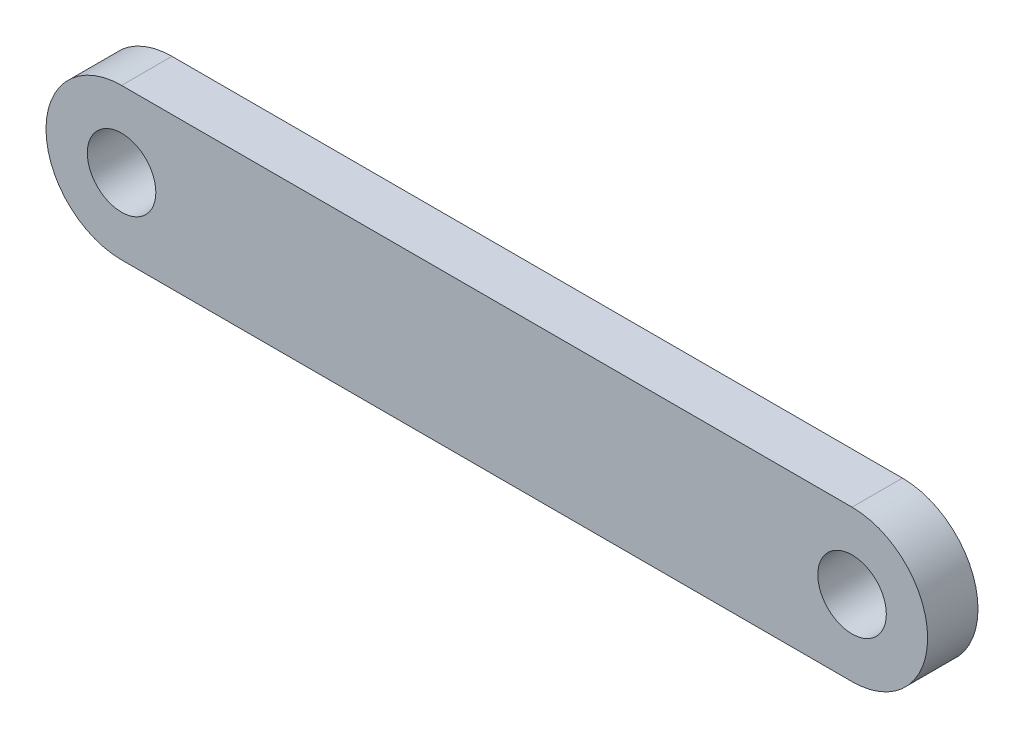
SolidWorks part; units mm, degrees
ref_plane "Front Plane" through (0, 0, 0) normal (0, 0, 1) x (1, 0, 0)
ref_plane "Top Plane" through (0, 0, 0) normal (0, 1, 0) x (1, 0, 0)
ref_plane "Right Plane" through (0, 0, 0) normal (1, 0, 0) x (0, 0, -1)
sketch "Sketch1" plane through (0, 0, 0) normal (0, 0, 1) x (1, 0, 0)
  line L0 (-47.625, 23.495) -> (-10.795, 23.495) construction
  line L1 (-47.625, 27.305) -> (-10.795, 27.305)
  line L2 (-47.625, 19.685) -> (-10.795, 19.685)
  arc A0 (-47.625, 27.305) -> (-47.625, 19.685) centre (-47.625, 23.495) ccw
  arc A1 (-10.795, 19.685) -> (-10.795, 27.305) centre (-10.795, 23.495) ccw
  point P2 (-29.21, 23.495)
  dimension "D1" = 3.81
extrude "Boss-Extrude1" add sketch "Sketch1" along normal blind 2.54
hole_wizard "#4 Clearance Hole1" positions "Sketch3" profile "Sketch2" hole size "#4" standard "ANSI Inch"
sketch "Sketch3" plane through (0, 0, 2.54) normal (0, 0, 1) x (1, 0, 0)
  point P0 (-47.625, 23.495)
  point P3 (-10.795, 23.495)
sketch "Sketch2" plane through (-47.625, 23.495, 2.54) normal (1, 0, 0) x (0, -1, 0)
  line L0 (0, 0) -> (0, 7.3878)
  line L1 (0, 7.3878) -> (1.7272, 6.35)
  line L2 (1.7272, 6.35) -> (1.7272, 0)
  line L5 (1.7272, 0) -> (0, 0)
  line L10 (0, 7.3878) -> (-1.7272, 6.35) construction
  line L11 (0, -6.35) -> (0, 107.95) construction
  dimension "Hole Dia." = 3.4544
  dimension "Hole Depth" = 6.35
  dimension "Drill Angle" = 118
